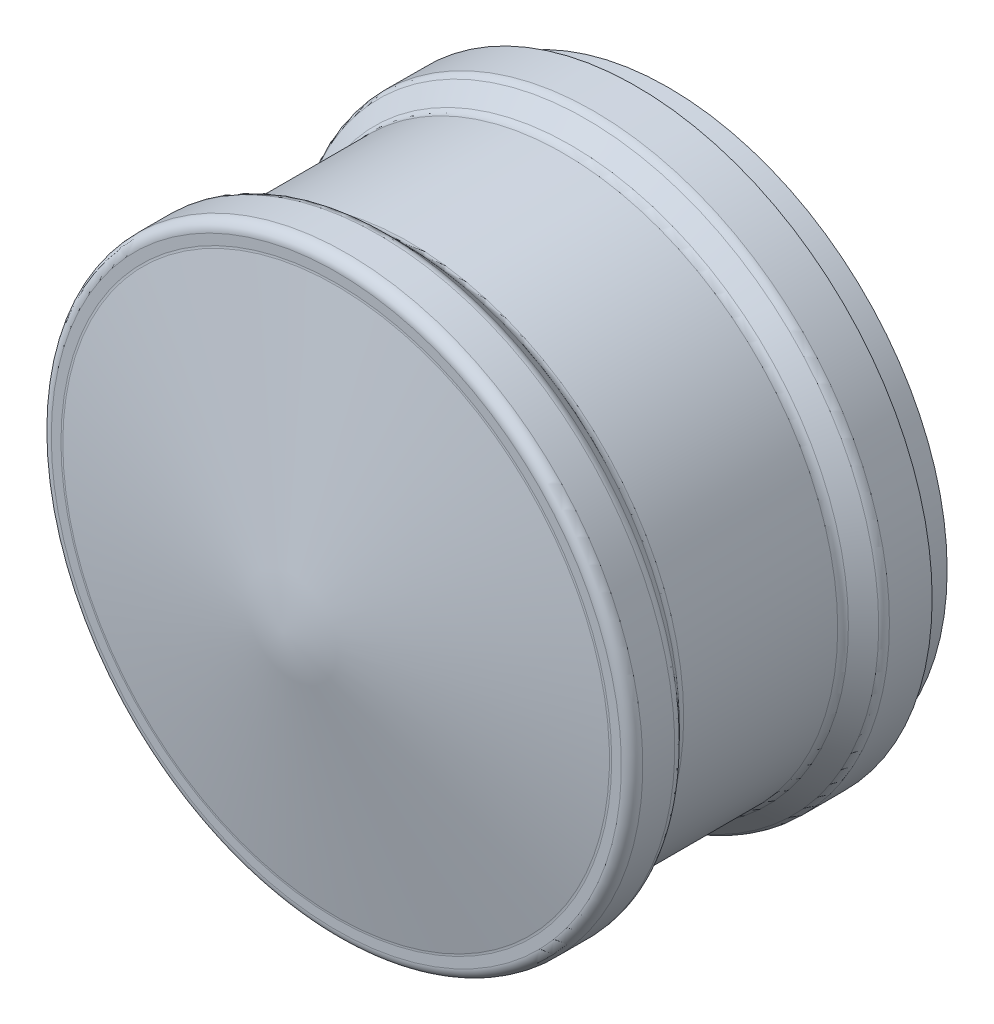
SolidWorks part; units mm, degrees
ref_plane "Face" through (0, 0, 0) normal (0, 0, 1) x (1, 0, 0)
ref_plane "Dessus" through (0, 0, 0) normal (0, 1, 0) x (1, 0, 0)
ref_plane "Droite" through (0, 0, 0) normal (1, 0, 0) x (0, 0, -1)
sketch "Esquisse1" plane through (0, 0, 0) normal (1, 0, 0) x (0, 0, -1)
  line L0 (-40.1567, 0) -> (24.3202, 0) construction
  line L1 (-15.5, 12.8) -> (-18, 0)
  line L2 (-15.5, 12.8) -> (-15.5, 13.8)
  line L3 (-15.5, 13.8) -> (-13.3, 13.8)
  line L4 (-13.3, 13.8) -> (-12.3, 12.8)
  line L5 (-12.3, 12.8) -> (-4.7, 12.8)
  line L6 (-4.7, 12.8) -> (-3.7, 13.8)
  line L7 (-3.7, 13.8) -> (-1.5, 13.8)
  line L8 (-1.5, 13.8) -> (-1.5, 12.5)
  line L9 (-1.5, 12.5) -> (-1.2, 12.5)
  line L10 (-1.2, 12.5) -> (-1.2, 13)
  line L11 (-1.2, 13) -> (0, 13)
  line L12 (0, 13) -> (0, 8.4)
  line L13 (0, 8.4) -> (-3.2, 8.4)
  line L14 (-3.2, 8.4) -> (-3.2, 9.9)
  line L15 (-3.2, 9.9) -> (-4.6, 9.9)
  line L16 (-4.6, 9.9) -> (-4.6, 8.6)
  line L17 (-4.6, 8.6) -> (-14.8, 0)
  line L18 (-14.8, 0) -> (-18, 0)
  dimension "D1" = 16.8
  dimension "D2" = 19.8
  dimension "D3" = 17.2
  dimension "D4" = 3.2
  dimension "D5" = 1.4
  dimension "D6" = 14.8
  dimension "D7" = 1.2
  dimension "D8" = 26
  dimension "D9" = 25
  dimension "D10" = 0.3
  dimension "D11" = 27.6
  dimension "D12" = 3.2
  dimension "D13" = 25.6
  dimension "D14" = 3.2
  dimension "D15" = 135
  dimension "D16" = 135
  dimension "D17" = 18
  dimension "D18" = 15.5
revolve "Base-Révolution" add sketch "Esquisse1" angle 360 about L0
fillet "Congé1" radius 0.5 6 edges at (12.8, 0, 15.5) (13.8, 0, 3.7) (12.8, 0, 4.7) (12.8, 0, 12.3) (13.8, 0, 13.3) (13.8, 0, 15.5)
chamfer "Chanfrein1" distance 0.5 angle 45 1 edges at (8.4, 0, 0)
